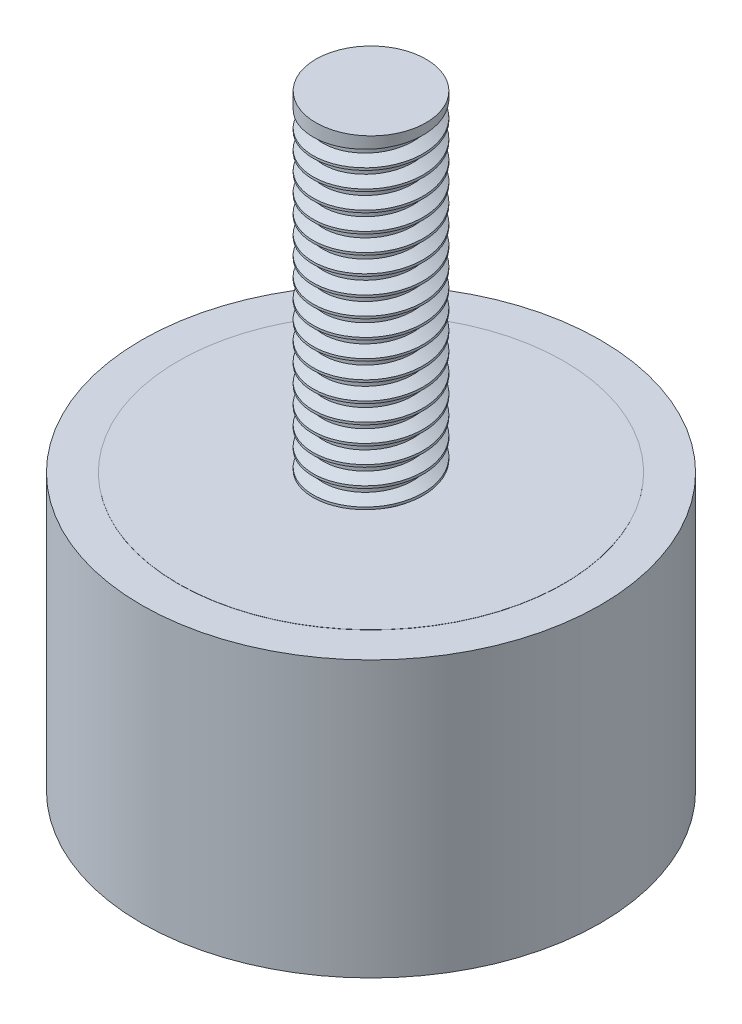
SolidWorks part; units mm, degrees
ref_plane "Front Plane" through (0, 0, 0) normal (0, 0, 1) x (1, 0, 0)
ref_plane "Top Plane" through (0, 0, 0) normal (0, 1, 0) x (1, 0, 0)
ref_plane "Right Plane" through (0, 0, 0) normal (1, 0, 0) x (0, 0, -1)
sketch "Sketch1" plane through (0, 0, 0) normal (0, 1, 0) x (1, 0, 0)
  circle A0 centre (0, 0) radius 12.5
  dimension "D1" = 25
extrude "Boss-Extrude1" add sketch "Sketch1" along normal blind 15
sketch "Sketch2" plane through (0, 15, 0) normal (0, 1, 0) x (1, 0, 0)
  circle A0 centre (0, 0) radius 3
  dimension "D1" = 6
extrude "Boss-Extrude2" add sketch "Sketch2" along normal blind 18
thread "Thread1" pitch 1 start angle 0, offset 0, length 18, pitch 1, diameter 6
ref_plane "Plane1" through (-3, 33, 0) normal (0, 0, 1) x (-1, 0, 0)
sketch "Thread Profile1" plane through (-3, 33, 0) normal (0, 0, 1) x (-1, 0, 0)
  line L0 (0, 0) -> (0, 1) construction
  line L11 (0, 0) -> (0, 0.875)
  line L12 (0, 0.875) -> (-0.5413, 0.5625)
  line L13 (-0.5413, 0.5625) -> (-0.5413, 0.3125)
  line L15 (-0.5413, 0.3125) -> (0, 0)
  line L17 (-0.5413, 0.4375) -> (0, 0.4375) construction
  point P2 (0, 0)
  dimension "Pitch" = 1
  dimension "Profile_Angle" = 60
  dimension "Profile_Land" = 0.25
  dimension "Profile_Height" = 0.5413
sketch "Sketch3" plane through (0, 15, 0) normal (0, 1, 0) x (1, 0, 0)
  circle A0 centre (0, 0) radius 10.5
  dimension "D1" = 21
extrude "Boss-Extrude3" add sketch "Sketch3" along normal blind 0.01
